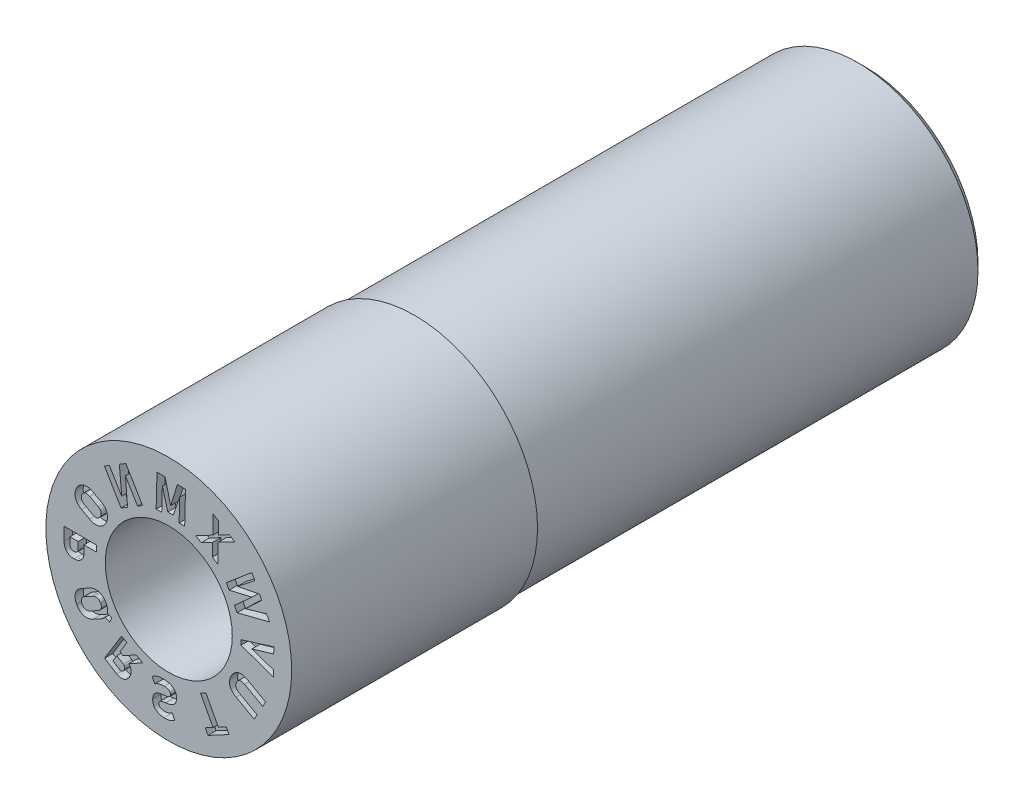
SolidWorks part; units mm, degrees
ref_plane "Front Plane" through (0, 0, 0) normal (0, 0, 1) x (1, 0, 0)
ref_plane "Top Plane" through (0, 0, 0) normal (0, 1, 0) x (1, 0, 0)
ref_plane "Right Plane" through (0, 0, 0) normal (1, 0, 0) x (0, 0, -1)
sketch "Sketch1" plane through (0, 0, 0) normal (1, 0, 0) x (0, 0, -1)
  line L2 (0, 3) -> (0, 1.55)
  line L3 (16.75, 3) -> (0, 3)
  line L4 (-3.7979, 0) -> (49996.2021, 0) construction
  line L8 (14, 0.8) -> (2.8, 0.8)
  line L9 (2.8, 1.55) -> (2.8, 0.8)
  line L10 (2.8, 1.55) -> (0, 1.55)
  line L12 (17, 1.5) -> (17, 2.75)
  line L16 (17, 2.75) -> (16.75, 3)
  line L17 (17, 1.5) -> (14, 1.5)
  line L18 (14, 0.8) -> (14, 1.5)
  dimension "D1" = 17
  dimension "D2" = 45
  dimension "D3" = 0.25
  dimension "D4" = 6
  dimension "D5" = 3.1
  dimension "D6" = 2.8
  dimension "D7" = 1.6
  dimension "D8" = 3
  dimension "D9" = 3
revolve "Revolve1" add sketch "Sketch1" angle 360 about L4
sketch "Sketch4" plane through (0, 0, 0) normal (1, 0, 0) x (0, 0, -1)
  line L0 (0, 0) -> (50000, 0) construction
  line L1 (17, -2.75) -> (17, 2.75) construction
  line L2 (6, 3.935) -> (17, 3.935)
  line L3 (6, 3.935) -> (6, 2.935)
  line L4 (6, 2.935) -> (17, 2.935)
  line L5 (17, 3.935) -> (17, 2.935)
  line L6 (16.75, 3) -> (0, 3) construction
  line L9 (0, 55) -> (0, -55) construction
  dimension "D1" = 1
  dimension "D2" = 0.065
  dimension "D3" = 6
revolve "Cut-Revolve1" cut sketch "Sketch4" angle 360 about L0
sketch "Sketch2" plane through (0, 0, 0) normal (0, 0, 1) x (1, 0, 0)
  line L0 (0, 0) -> (0, 3.4353) construction
  line L1 (0, 0) -> (1.7177, 2.9751) construction
  line L2 (0, 0) -> (2.9751, 1.7177) construction
  line L3 (0, 0) -> (3.4353, 0) construction
  line L4 (0, 0) -> (2.9751, -1.7177) construction
  line L5 (0, 0) -> (1.7177, -2.9751) construction
  line L6 (0, 0) -> (0, -3.4353) construction
  line L7 (0, 0) -> (-1.7177, -2.9751) construction
  line L8 (0, 0) -> (-2.9751, -1.7177) construction
  line L9 (0, 0) -> (-3.4353, 0) construction
  line L10 (0, 0) -> (-2.9751, 1.7177) construction
  line L11 (0, 0) -> (-1.7177, 2.9751) construction
  line L12 (2.27, 1.1094) -> (2.215, 1.216)
  line L13 (2.215, 1.216) -> (1.6756, 1.1087)
  line L14 (1.6756, 1.1087) -> (2.099, 1.4414)
  line L15 (2.099, 1.4414) -> (2.0286, 1.5782)
  line L16 (2.0286, 1.5782) -> (1.4075, 1.0528)
  line L17 (1.4075, 1.0528) -> (1.4718, 0.9277)
  line L18 (1.4718, 0.9277) -> (2.0287, 1.0563)
  line L19 (2.0287, 1.0563) -> (1.6037, 0.6719)
  line L20 (1.6037, 0.6719) -> (1.6681, 0.5468)
  line L21 (1.6681, 0.5468) -> (2.4564, 0.7472)
  line L22 (2.4564, 0.7472) -> (2.386, 0.884)
  line L23 (2.386, 0.884) -> (1.8692, 0.7325)
  line L24 (1.8692, 0.7325) -> (2.27, 1.1094)
  line L25 (-2.0688, 0.1133) -> (-1.761, 0.1125)
  line L26 (1.2076, 1.807) -> (1.6083, 2.0168)
  line L27 (1.6083, 2.0168) -> (1.4743, 2.0998)
  line L28 (1.4743, 2.0998) -> (1.2114, 1.9621)
  line L29 (-1.1147, -1.7532) -> (-1.1919, -1.7058)
  line L30 (1.0734, 1.8897) -> (0.6564, 1.6718)
  line L31 (0.6564, 1.6718) -> (0.7908, 1.5888)
  line L32 (0.7908, 1.5888) -> (1.0697, 1.735)
  line L33 (1.2114, 1.9621) -> (1.2187, 2.2579)
  line L34 (1.2187, 2.2579) -> (1.0843, 2.3409)
  line L35 (1.0843, 2.3409) -> (1.0734, 1.8897)
  line L36 (1.0697, 1.735) -> (1.0621, 1.421)
  line L37 (1.0621, 1.421) -> (1.1963, 1.3379)
  line L38 (1.1963, 1.3379) -> (1.2076, 1.807)
  line L39 (-0.0906, 2.5387) -> (-0.2877, 2.5439)
  line L40 (-0.2877, 2.5439) -> (-0.308, 1.7507)
  line L41 (-0.308, 1.7507) -> (-0.172, 1.7472)
  line L42 (-0.172, 1.7472) -> (-0.1576, 2.31)
  line L43 (-1.1919, -1.7058) -> (-1.025, -1.4337)
  line L44 (-0.1576, 2.31) -> (-0.0236, 1.8318)
  line L45 (-0.0236, 1.8318) -> (0.1085, 1.8284)
  line L46 (0.1085, 1.8284) -> (0.2667, 2.2897)
  line L47 (1.0806, -2.1716) -> (0.8899, -2.2734)
  line L48 (0.2667, 2.2897) -> (0.2524, 1.7363)
  line L49 (0.2524, 1.7363) -> (0.3882, 1.7328)
  line L50 (0.3882, 1.7328) -> (0.4085, 2.526)
  line L51 (0.4085, 2.526) -> (0.2116, 2.531)
  line L52 (0.2116, 2.531) -> (0.0468, 2.0004)
  line L53 (0.0468, 2.0004) -> (-0.0906, 2.5387)
  line L54 (-1.048, 2.3421) -> (-1.2055, 2.248)
  line L55 (-1.2055, 2.248) -> (-1.1495, 1.6028)
  line L57 (-1.1495, 1.6028) -> (-1.4485, 2.1029)
  line L58 (-1.4485, 2.1029) -> (-1.5717, 2.0292)
  line L59 (-1.5717, 2.0292) -> (-1.1635, 1.3463)
  line L60 (-1.1635, 1.3463) -> (-1.005, 1.441)
  line L61 (-1.005, 1.441) -> (-1.0576, 2.0787)
  line L63 (-1.0576, 2.0787) -> (-0.7629, 1.5857)
  line L64 (-0.7629, 1.5857) -> (-0.6398, 1.6592)
  line L65 (-0.6398, 1.6592) -> (-1.048, 2.3421)
  line L66 (-1.6537, 1.2347) -> (-1.8513, 1.343)
  line L67 (-2.1305, 0.8335) -> (-1.9329, 0.7252)
  line L68 (-1.8548, 0.8595) -> (-2.0593, 0.9715)
  line L69 (-1.9293, 1.2086) -> (-1.7248, 1.0966)
  line L70 (-2.2128, 0.1136) -> (-2.2132, -0.0587)
  line L71 (-2.4106, -0.0582) -> (-2.4102, 0.1141)
  line L73 (-2.5538, 0.264) -> (-2.5546, -0.0541)
  line L74 (-2.0692, -0.0554) -> (-2.0688, 0.1133)
  line L77 (-2.4102, 0.1141) -> (-2.2128, 0.1136)
  line L78 (-1.761, 0.1125) -> (-1.7606, 0.262)
  line L79 (-1.7606, 0.262) -> (-2.5538, 0.264)
  line L81 (-1.552, -1.16) -> (-1.4424, -1.2089)
  line L82 (-1.4424, -1.2089) -> (-1.3917, -1.0895)
  line L83 (-1.3917, -1.0895) -> (-1.496, -1.0431)
  line L84 (-1.9308, -0.7293) -> (-2.1286, -0.8382)
  line L85 (-1.848, -1.3483) -> (-1.6502, -1.2394)
  line L86 (-1.7217, -1.1011) -> (-1.9264, -1.2137)
  line L87 (-2.0571, -0.9765) -> (-1.8524, -0.8639)
  line L88 (-1.2672, -1.8286) -> (-1.1088, -1.9258)
  line L89 (-1.2063, -2.0849) -> (-1.3648, -1.9877)
  line L91 (-1.5675, -2.0322) -> (-1.2714, -2.2139)
  line L95 (-1.3648, -1.9877) -> (-1.2672, -1.8286)
  line L96 (-1.025, -1.4337) -> (-1.1525, -1.3555)
  line L97 (-1.1525, -1.3555) -> (-1.5675, -2.0322)
  line L99 (-0.9734, -1.8491) -> (-0.6409, -1.6695)
  line L100 (-0.6409, -1.6695) -> (-0.7953, -1.5747)
  line L101 (-0.7953, -1.5747) -> (-1.1147, -1.7532)
  line L102 (-0.403, -1.8332) -> (-0.3407, -1.9604)
  line L103 (0.0413, -1.9987) -> (0.0412, -1.9991)
  line L104 (-0.1094, -2.0852) -> (-0.1214, -2.0862)
  line L105 (-0.392, -2.3026) -> (-0.3921, -2.3033)
  line L106 (0.1458, -2.4949) -> (0.0898, -2.3647)
  line L107 (-0.2445, -2.3258) -> (-0.2446, -2.3253)
  line L108 (0.1894, -2.011) -> (0.1893, -2.0099)
  line L110 (1.2123, -2.1013) -> (0.9066, -1.5284)
  line L111 (0.9066, -1.5284) -> (0.7749, -1.5988)
  line L112 (0.7749, -1.5988) -> (1.0806, -2.1716)
  line L113 (0.9577, -2.4005) -> (1.4707, -2.1266)
  line L114 (1.4707, -2.1266) -> (1.4029, -1.9995)
  line L115 (1.4029, -1.9995) -> (1.2123, -2.1013)
  line L116 (0.8899, -2.2734) -> (0.9577, -2.4005)
  line L117 (1.6427, -1.2491) -> (2.0833, -1.4956)
  line L118 (2.0833, -1.4956) -> (2.1561, -1.3654)
  line L119 (2.1561, -1.3654) -> (1.7123, -1.1172)
  line L120 (1.8488, -0.8732) -> (2.2926, -1.1214)
  line L121 (2.2926, -1.1214) -> (2.3654, -0.9913)
  line L122 (2.3654, -0.9913) -> (1.9248, -0.7449)
  line L123 (2.5516, -0.37) -> (2.5546, -0.2161)
  line L124 (2.5546, -0.2161) -> (2.029, -0.0371)
  line L125 (2.029, -0.0371) -> (2.5614, 0.1209)
  line L126 (2.5614, 0.1209) -> (2.5644, 0.2748)
  line L127 (2.5644, 0.2748) -> (1.766, 0.0267)
  line L128 (1.766, 0.0267) -> (1.7636, -0.0902)
  line L129 (1.7636, -0.0902) -> (2.5516, -0.37)
  circle A0 centre (0, 0) radius 1.7947 construction
  spline S0 degree 3 poles (-1.5359, 0.839) (-1.5291, 0.8513) (-1.5201, 0.87) (-1.5105, 0.8956) (-1.5047, 0.9145) (-1.5002, 0.9334) (-1.4969, 0.9523) (-1.4952, 0.9712) (-1.4944, 0.9899) (-1.4952, 1.0086) (-1.4971, 1.0268) (-1.5002, 1.0449) (-1.5051, 1.0624) (-1.5106, 1.0797) (-1.5178, 1.0966) (-1.5263, 1.113) (-1.5357, 1.1292) (-1.5467, 1.1446) (-1.5585, 1.1597) (-1.5717, 1.1739) (-1.5859, 1.1874) (-1.6011, 1.2005) (-1.6234, 1.2168) (-1.6413, 1.2278) (-1.6537, 1.2347) knots 0 0 0 0 0.090417 0.133864 0.176276 0.217818 0.259154 0.299759 0.340251 0.380131 0.419768 0.458883 0.497906 0.537021 0.576163 0.61597 0.656312 0.697015 0.737895 0.779553 0.821787 0.864666 0.908561 1 1 1 1
  spline S1 degree 3 poles (-1.8513, 1.343) (-1.8638, 1.3497) (-1.8825, 1.3592) (-1.9085, 1.3688) (-1.9275, 1.3748) (-1.9466, 1.3795) (-1.9656, 1.3829) (-1.9846, 1.3847) (-2.0035, 1.3857) (-2.0222, 1.3848) (-2.0406, 1.3833) (-2.0586, 1.38) (-2.0762, 1.3756) (-2.0935, 1.37) (-2.1103, 1.363) (-2.127, 1.355) (-2.143, 1.3455) (-2.1584, 1.3348) (-2.1735, 1.3231) (-2.1876, 1.3102) (-2.2011, 1.2962) (-2.2139, 1.281) (-2.2303, 1.2592) (-2.2412, 1.2415) (-2.2479, 1.2292) knots 0 0 0 0 0.091509 0.13546 0.178154 0.220455 0.262042 0.302878 0.343583 0.383955 0.423455 0.462585 0.501839 0.540633 0.57985 0.619401 0.659411 0.700117 0.740632 0.781904 0.823734 0.866298 0.909762 1 1 1 1
  spline S2 degree 3 poles (-2.2479, 1.2292) (-2.2548, 1.217) (-2.2637, 1.1982) (-2.2734, 1.1726) (-2.2791, 1.1537) (-2.2839, 1.1348) (-2.2869, 1.1159) (-2.2889, 1.097) (-2.2895, 1.0781) (-2.2889, 1.0595) (-2.2867, 1.0411) (-2.2836, 1.0232) (-2.2791, 1.0056) (-2.2733, 0.9884) (-2.2662, 0.9716) (-2.258, 0.9551) (-2.2482, 0.9391) (-2.2376, 0.9235) (-2.2255, 0.9087) (-2.2126, 0.8943) (-2.1983, 0.8808) (-2.1831, 0.8677) (-2.1608, 0.8514) (-2.1429, 0.8404) (-2.1305, 0.8335) knots 0 0 0 0 0.090428 0.133879 0.176296 0.218093 0.259201 0.300026 0.340522 0.380882 0.420369 0.459489 0.498292 0.537327 0.576473 0.615974 0.65631 0.697004 0.737925 0.779528 0.821767 0.864651 0.908551 1 1 1 1
  spline S3 degree 3 poles (-1.9329, 0.7252) (-1.9204, 0.7185) (-1.9017, 0.7089) (-1.8757, 0.6995) (-1.8567, 0.6932) (-1.8376, 0.6888) (-1.8185, 0.6853) (-1.7994, 0.6834) (-1.7805, 0.6826) (-1.7618, 0.6829) (-1.7434, 0.685) (-1.7254, 0.688) (-1.7077, 0.6923) (-1.6904, 0.698) (-1.6735, 0.705) (-1.657, 0.7132) (-1.6409, 0.7227) (-1.6254, 0.7335) (-1.6104, 0.7451) (-1.5963, 0.758) (-1.5827, 0.7721) (-1.5699, 0.7872) (-1.5535, 0.8091) (-1.5426, 0.8268) (-1.5359, 0.839) knots 0 0 0 0 0.091419 0.135326 0.178245 0.220253 0.261799 0.303083 0.343748 0.38396 0.423573 0.462799 0.501686 0.540778 0.579956 0.619429 0.659747 0.700413 0.740888 0.782119 0.823908 0.86643 0.909851 1 1 1 1
  spline S4 degree 3 poles (-1.6675, 0.9111) (-1.6739, 0.9001) (-1.6842, 0.8841) (-1.7023, 0.8672) (-1.7164, 0.8566) (-1.7319, 0.8486) (-1.748, 0.8426) (-1.7651, 0.8394) (-1.7827, 0.8386) (-1.8007, 0.8399) (-1.8255, 0.8455) (-1.8434, 0.853) (-1.8548, 0.8595) knots 0 0 0 0 0.175066 0.257026 0.337672 0.416954 0.494877 0.572754 0.653437 0.735689 0.820268 1 1 1 1
  spline S5 degree 3 poles (-2.0593, 0.9715) (-2.0708, 0.9777) (-2.0867, 0.9888) (-2.1048, 1.0065) (-2.1157, 1.021) (-2.1247, 1.0363) (-2.1308, 1.0524) (-2.1348, 1.0692) (-2.136, 1.0866) (-2.1349, 1.1043) (-2.1303, 1.1286) (-2.1226, 1.146) (-2.1166, 1.1572) knots 0 0 0 0 0.179291 0.263984 0.346173 0.426703 0.505006 0.582502 0.662079 0.742384 0.824865 1 1 1 1
  spline S6 degree 3 poles (-2.1166, 1.1572) (-2.1105, 1.1684) (-2.0996, 1.1839) (-2.0819, 1.2011) (-2.0677, 1.2116) (-2.0523, 1.2197) (-2.0361, 1.2254) (-2.0191, 1.2287) (-2.0014, 1.2295) (-1.9834, 1.2281) (-1.9587, 1.2222) (-1.9407, 1.2151) (-1.9293, 1.2086) knots 0 0 0 0 0.175013 0.257189 0.337906 0.416522 0.494678 0.572624 0.653378 0.736149 0.820282 1 1 1 1
  spline S7 degree 3 poles (-1.7248, 1.0966) (-1.7133, 1.0903) (-1.6974, 1.0791) (-1.6793, 1.0615) (-1.6684, 1.047) (-1.6595, 1.0318) (-1.6533, 1.0156) (-1.6493, 0.9989) (-1.648, 0.9816) (-1.6491, 0.964) (-1.654, 0.9397) (-1.6614, 0.9222) (-1.6675, 0.9111) knots 0 0 0 0 0.180158 0.264225 0.346507 0.427127 0.505518 0.583101 0.661767 0.742163 0.825247 1 1 1 1
  spline S8 degree 3 poles (-2.2132, -0.0587) (-2.2132, -0.0672) (-2.2148, -0.0797) (-2.2198, -0.0954) (-2.2254, -0.1059) (-2.232, -0.1157) (-2.2403, -0.1242) (-2.2496, -0.1317) (-2.2603, -0.1379) (-2.2718, -0.1431) (-2.2889, -0.1477) (-2.3023, -0.1492) (-2.3115, -0.1491) knots 0 0 0 0 0.169702 0.250142 0.328711 0.407037 0.48557 0.564516 0.646217 0.731139 0.816416 1 1 1 1
  spline S9 degree 3 poles (-2.3115, -0.1491) (-2.3208, -0.1491) (-2.3346, -0.1479) (-2.3519, -0.1429) (-2.3637, -0.138) (-2.3743, -0.1318) (-2.3838, -0.1244) (-2.392, -0.1158) (-2.3989, -0.1061) (-2.4041, -0.0953) (-2.4094, -0.0795) (-2.4105, -0.0668) (-2.4106, -0.0582) knots 0 0 0 0 0.184774 0.271288 0.355539 0.436838 0.515203 0.59372 0.671031 0.749802 0.829807 1 1 1 1
  spline S10 degree 3 poles (-2.5546, -0.0541) (-2.5548, -0.0775) (-2.5514, -0.112) (-2.5387, -0.1554) (-2.5255, -0.1849) (-2.5089, -0.2117) (-2.489, -0.2355) (-2.4659, -0.2561) (-2.4398, -0.2732) (-2.4111, -0.2871) (-2.3686, -0.3002) (-2.3349, -0.3042) (-2.312, -0.304) knots 0 0 0 0 0.179097 0.263089 0.34501 0.42542 0.50381 0.581804 0.661048 0.742193 0.824608 1 1 1 1
  spline S11 degree 3 poles (-2.312, -0.304) (-2.2891, -0.3041) (-2.2553, -0.3006) (-2.213, -0.2874) (-2.1844, -0.2738) (-2.1583, -0.2568) (-2.1353, -0.2363) (-2.1155, -0.2126) (-2.0988, -0.186) (-2.0857, -0.1566) (-2.0725, -0.1134) (-2.0693, -0.0788) (-2.0692, -0.0554) knots 0 0 0 0 0.175511 0.257972 0.338737 0.418047 0.495879 0.574237 0.654395 0.73617 0.820238 1 1 1 1
  spline S12 degree 3 poles (-1.533, -0.8425) (-1.5396, -0.8301) (-1.5508, -0.8126) (-1.567, -0.7906) (-1.58, -0.7756) (-1.5936, -0.7616) (-1.6079, -0.7487) (-1.6228, -0.737) (-1.6384, -0.7263) (-1.6546, -0.7169) (-1.6711, -0.7087) (-1.6881, -0.7019) (-1.7053, -0.6961) (-1.723, -0.6919) (-1.7411, -0.6886) (-1.7596, -0.687) (-1.7784, -0.6865) (-1.7973, -0.687) (-1.8163, -0.6894) (-1.8354, -0.6924) (-1.8545, -0.6974) (-1.8736, -0.7033) (-1.8995, -0.7131) (-1.9183, -0.7227) (-1.9308, -0.7293) knots 0 0 0 0 0.090195 0.133685 0.176153 0.21789 0.25907 0.299873 0.340488 0.380409 0.420177 0.459306 0.497928 0.537094 0.576457 0.616177 0.656458 0.697162 0.738123 0.77964 0.821845 0.864668 0.90852 1 1 1 1
  spline S13 degree 3 poles (-2.1286, -0.8382) (-2.1409, -0.8452) (-2.159, -0.856) (-2.1812, -0.8726) (-2.1964, -0.8856) (-2.2108, -0.8991) (-2.2238, -0.9135) (-2.2358, -0.9285) (-2.2466, -0.9441) (-2.2562, -0.9602) (-2.2646, -0.9767) (-2.2716, -0.9936) (-2.2773, -1.0109) (-2.282, -1.0285) (-2.2851, -1.0465) (-2.2871, -1.0649) (-2.2878, -1.0835) (-2.287, -1.1024) (-2.2853, -1.1213) (-2.2819, -1.1402) (-2.2772, -1.1591) (-2.2715, -1.1781) (-2.2616, -1.2036) (-2.2526, -1.2224) (-2.2458, -1.2347) knots 0 0 0 0 0.091422 0.135239 0.178146 0.22039 0.261975 0.303164 0.343795 0.384056 0.423794 0.462866 0.501828 0.540782 0.58015 0.619563 0.659673 0.700093 0.740901 0.782164 0.823633 0.866196 0.909567 1 1 1 1
  spline S14 degree 3 poles (-2.2458, -1.2347) (-2.2392, -1.2471) (-2.228, -1.2645) (-2.2118, -1.2867) (-2.1987, -1.3016) (-2.1853, -1.3158) (-2.171, -1.3286) (-2.156, -1.3404) (-2.1404, -1.351) (-2.1243, -1.3605) (-2.1077, -1.3686) (-2.0908, -1.3757) (-2.0735, -1.3812) (-2.0558, -1.3858) (-2.0377, -1.3886) (-2.0193, -1.3905) (-2.0006, -1.391) (-1.9816, -1.3904) (-1.9626, -1.3883) (-1.9435, -1.3849) (-1.9244, -1.3803) (-1.9052, -1.3743) (-1.8793, -1.3645) (-1.8606, -1.3549) (-1.848, -1.3483) knots 0 0 0 0 0.090173 0.133652 0.176442 0.217915 0.259084 0.299878 0.340482 0.38074 0.420154 0.459214 0.498247 0.537295 0.576462 0.616016 0.656288 0.696981 0.738203 0.779453 0.821889 0.864701 0.908542 1 1 1 1
  spline S15 degree 3 poles (-1.6502, -1.2394) (-1.6379, -1.2323) (-1.6198, -1.2216) (-1.5976, -1.2049) (-1.5824, -1.1919) (-1.5681, -1.1783) (-1.5583, -1.1675) (-1.5531, -1.1613) (-1.552, -1.16) knots 0 0 0 0 0.091371 0.135164 0.178378 0.220178 0.26174 0.272413 0.272413 0.272413 0.272413
  spline S16 degree 3 poles (-1.6647, -0.9149) (-1.6586, -0.9262) (-1.6512, -0.9437) (-1.6461, -0.968) (-1.6451, -0.9857) (-1.6464, -1.003) (-1.6502, -1.0198) (-1.6565, -1.0359) (-1.6653, -1.0512) (-1.6761, -1.0658) (-1.6942, -1.0836) (-1.7101, -1.0949) (-1.7217, -1.1011) knots 0 0 0 0 0.175738 0.25757 0.338359 0.417478 0.494864 0.572915 0.653331 0.735404 0.819977 1 1 1 1
  spline S17 degree 3 poles (-1.9264, -1.2137) (-1.9379, -1.2199) (-1.9557, -1.2278) (-1.9806, -1.2332) (-1.9987, -1.2349) (-2.0163, -1.2339) (-2.0334, -1.2308) (-2.0496, -1.2248) (-2.0651, -1.2169) (-2.0794, -1.2064) (-2.0973, -1.1893) (-2.108, -1.1735) (-2.1143, -1.1623) knots 0 0 0 0 0.179094 0.264009 0.346524 0.426668 0.505058 0.582809 0.661917 0.742385 0.824306 1 1 1 1
  spline S18 degree 3 poles (-2.1143, -1.1623) (-2.1202, -1.1511) (-2.1279, -1.1337) (-2.1327, -1.1094) (-2.1339, -1.0918) (-2.1326, -1.0744) (-2.1287, -1.0576) (-2.1223, -1.0414) (-2.1136, -1.0261) (-2.1026, -1.0117) (-2.0846, -0.9938) (-2.0687, -0.9826) (-2.0571, -0.9765) knots 0 0 0 0 0.174878 0.257325 0.337598 0.416796 0.494956 0.573085 0.653582 0.735801 0.820459 1 1 1 1
  spline S19 degree 3 poles (-1.8524, -0.8639) (-1.8409, -0.8575) (-1.823, -0.8498) (-1.7983, -0.8441) (-1.7802, -0.8427) (-1.7626, -0.8434) (-1.7455, -0.8466) (-1.7293, -0.8525) (-1.7139, -0.8607) (-1.6996, -0.8711) (-1.6817, -0.8882) (-1.6708, -0.9036) (-1.6647, -0.9149) knots 0 0 0 0 0.179889 0.264361 0.346508 0.427089 0.505553 0.583377 0.662501 0.743044 0.825043 1 1 1 1
  spline S20 degree 3 poles (-1.1088, -1.9258) (-1.1025, -1.9294) (-1.0941, -1.9364) (-1.0851, -1.9476) (-1.08, -1.9567) (-1.0763, -1.9665) (-1.074, -1.9768) (-1.0733, -1.9877) (-1.0741, -1.999) (-1.0764, -2.0106) (-1.0814, -2.0267) (-1.087, -2.0384) (-1.0916, -2.0459) knots 0 0 0 0 0.160364 0.237859 0.313887 0.390284 0.466266 0.546044 0.629075 0.716185 0.805143 1 1 1 1
  spline S21 degree 3 poles (-1.0916, -2.0459) (-1.096, -2.0535) (-1.1038, -2.0638) (-1.1157, -2.0756) (-1.1249, -2.0829) (-1.1348, -2.0885) (-1.1447, -2.093) (-1.1549, -2.0955) (-1.1653, -2.0969) (-1.1757, -2.0962) (-1.1899, -2.0935) (-1.2, -2.0888) (-1.2063, -2.0849) knots 0 0 0 0 0.192245 0.281877 0.368857 0.450818 0.530412 0.606943 0.682726 0.759211 0.836072 1 1 1 1
  spline S22 degree 3 poles (-1.2714, -2.2139) (-1.2537, -2.2246) (-1.226, -2.238) (-1.1868, -2.2471) (-1.1579, -2.2499) (-1.1294, -2.2482) (-1.1014, -2.2426) (-1.0743, -2.2325) (-1.0482, -2.2187) (-1.0234, -2.2011) (-0.9919, -2.1717) (-0.9719, -2.1455) (-0.9604, -2.1264) knots 0 0 0 0 0.170511 0.251264 0.330555 0.409169 0.486587 0.565367 0.64627 0.729871 0.815831 1 1 1 1
  spline S23 degree 3 poles (-0.9604, -2.1264) (-0.9488, -2.1073) (-0.9339, -2.0777) (-0.9224, -2.0363) (-0.9177, -2.0061) (-0.9173, -1.9766) (-0.9207, -1.9478) (-0.9285, -1.9204) (-0.9402, -1.8941) (-0.9552, -1.8701) (-0.9672, -1.8557) (-0.9734, -1.8491) knots 0 0 0 0 0.184351 0.270499 0.353948 0.435216 0.513625 0.591508 0.669793 0.749625 0.824263 0.824263 0.824263 0.824263
  spline S24 degree 3 poles (-0.0991, -1.752) (-0.1178, -1.7507) (-0.1459, -1.7508) (-0.1831, -1.7534) (-0.2105, -1.7569) (-0.2375, -1.7617) (-0.264, -1.7678) (-0.2895, -1.7757) (-0.3144, -1.7846) (-0.3383, -1.7949) (-0.3686, -1.8098) (-0.3896, -1.8236) (-0.403, -1.8332) knots 0 0 0 0 0.175416 0.262021 0.348577 0.434225 0.518718 0.602045 0.68455 0.765576 0.845407 1 1 1 1
  spline S25 degree 3 poles (-0.3407, -1.9604) (-0.3247, -1.9486) (-0.2987, -1.9331) (-0.2613, -1.9174) (-0.2316, -1.9079) (-0.201, -1.9008) (-0.1596, -1.8943) (-0.1281, -1.894) (-0.1072, -1.895) knots 0 0 0 0 0.241526 0.365037 0.491761 0.619343 0.745896 1 1 1 1
  spline S26 degree 3 poles (-0.1072, -1.895) (-0.0957, -1.8959) (-0.0789, -1.8972) (-0.0574, -1.9011) (-0.0428, -1.9047) (-0.0292, -1.9088) (-0.0168, -1.914) (-0.0054, -1.9196) (0.0049, -1.9261) (0.014, -1.9331) (0.0218, -1.9408) (0.0285, -1.949) (0.0336, -1.9579) (0.0377, -1.9672) (0.041, -1.9809) (0.0417, -1.9915) (0.0413, -1.9987) knots 0 0 0 0 0.170677 0.249019 0.323 0.392902 0.459277 0.52134 0.58161 0.637818 0.691741 0.743614 0.793212 0.843555 0.893764 1 1 1 1
  spline S27 degree 3 poles (0.0412, -1.9991) (0.0408, -2.0088) (0.0379, -2.0227) (0.0292, -2.0389) (0.0206, -2.0487) (0.0103, -2.0569) (-0.0014, -2.0636) (-0.0142, -2.0692) (-0.0285, -2.0733) (-0.0444, -2.0765) (-0.0694, -2.0808) (-0.0892, -2.0832) (-0.1031, -2.0844) knots 0 0 0 0 0.15562 0.226283 0.29512 0.36531 0.436884 0.512161 0.590594 0.676778 0.774614 1 1 1 1
  spline S28 degree 3 poles (-0.1031, -2.0844) (-0.1041, -2.085) (-0.1063, -2.0849) (-0.1084, -2.0848) (-0.1094, -2.0852) knots 0 0 0 0 0.504196 1 1 1 1
  spline S29 degree 3 poles (-0.1214, -2.0862) (-0.146, -2.0888) (-0.1814, -2.0929) (-0.2258, -2.1023) (-0.2548, -2.1095) (-0.2813, -2.1192) (-0.3056, -2.1328) (-0.328, -2.1501) (-0.345, -2.1672) (-0.3574, -2.1829) (-0.3657, -2.1961) (-0.3728, -2.2107) (-0.3787, -2.2266) (-0.3837, -2.2438) (-0.3892, -2.2691) (-0.3911, -2.289) (-0.392, -2.3026) knots 0 0 0 0 0.190654 0.273941 0.349427 0.420098 0.490876 0.562744 0.637428 0.675985 0.716053 0.757512 0.800768 0.846658 0.895026 1 1 1 1
  spline S30 degree 3 poles (-0.3921, -2.3033) (-0.3928, -2.3156) (-0.393, -2.334) (-0.3904, -2.358) (-0.3879, -2.375) (-0.384, -2.3915) (-0.3788, -2.4072) (-0.3727, -2.4224) (-0.3655, -2.4368) (-0.3573, -2.4507) (-0.3476, -2.4635) (-0.3375, -2.476) (-0.3259, -2.4874) (-0.3136, -2.4981) (-0.3001, -2.5081) (-0.2856, -2.5173) (-0.2701, -2.5259) (-0.2537, -2.5335) (-0.2363, -2.5402) (-0.2181, -2.5464) (-0.1989, -2.5513) (-0.1789, -2.5557) (-0.1504, -2.5602) (-0.1286, -2.5627) (-0.1136, -2.5633) knots 0 0 0 0 0.086193 0.127121 0.167038 0.205954 0.244115 0.28193 0.319274 0.356372 0.393427 0.430721 0.46769 0.505864 0.544412 0.584049 0.624955 0.666819 0.709819 0.754195 0.799943 0.847313 0.896373 1 1 1 1
  spline S31 degree 3 poles (-0.1136, -2.5633) (-0.0993, -2.564) (-0.0775, -2.5641) (-0.0482, -2.5617) (-0.0183, -2.5576) (0.019, -2.5495) (0.0777, -2.5311) (0.1194, -2.5108) (0.1458, -2.4949) knots 0 0 0 0 0.158393 0.240052 0.323318 0.491049 0.660456 1 1 1 1
  spline S32 degree 3 poles (0.0898, -2.3647) (0.0742, -2.3742) (0.0501, -2.3868) (0.0167, -2.4004) (-0.0083, -2.4088) (-0.0333, -2.4149) (-0.0656, -2.4205) (-0.0897, -2.4214) (-0.1054, -2.4205) knots 0 0 0 0 0.265833 0.396076 0.524578 0.649927 0.770631 1 1 1 1
  spline S33 degree 3 poles (-0.1054, -2.4205) (-0.1162, -2.4196) (-0.132, -2.4185) (-0.1521, -2.4146) (-0.1658, -2.4114) (-0.1784, -2.4076) (-0.1901, -2.4031) (-0.2007, -2.3979) (-0.2103, -2.3919) (-0.2189, -2.3855) (-0.2262, -2.3784) (-0.2325, -2.371) (-0.2373, -2.3629) (-0.241, -2.3544) (-0.2442, -2.342) (-0.2449, -2.3323) (-0.2445, -2.3258) knots 0 0 0 0 0.172873 0.252209 0.326759 0.396746 0.462659 0.525763 0.585763 0.642831 0.69615 0.747834 0.797535 0.846062 0.895882 1 1 1 1
  spline S34 degree 3 poles (-0.2446, -2.3253) (-0.244, -2.3149) (-0.2412, -2.2997) (-0.2316, -2.2823) (-0.2221, -2.2719) (-0.2111, -2.2632) (-0.199, -2.2559) (-0.1857, -2.25) (-0.1711, -2.2455) (-0.1545, -2.2419) (-0.1271, -2.236) (-0.1048, -2.2334) (-0.0891, -2.2308) knots 0 0 0 0 0.156303 0.226416 0.295801 0.365383 0.43556 0.507496 0.581531 0.664437 0.761877 1 1 1 1
  spline S35 degree 3 poles (-0.0891, -2.2308) (-0.0877, -2.2303) (-0.0847, -2.2306) (-0.0817, -2.2299) (-0.0802, -2.2297) knots 0 0 0 0 0.498578 1 1 1 1
  spline S36 degree 3 poles (-0.0802, -2.2297) (-0.0781, -2.2293) (-0.0738, -2.229) (-0.0697, -2.2278) (-0.0675, -2.2277) knots 0 0 0 0 0.492192 1 1 1 1
  spline S37 degree 3 poles (-0.0675, -2.2277) (-0.0441, -2.2245) (-0.0104, -2.2186) (0.032, -2.2081) (0.0599, -2.1998) (0.0853, -2.189) (0.1085, -2.1749) (0.1297, -2.1573) (0.1457, -2.1402) (0.1572, -2.1248) (0.1647, -2.1118) (0.1715, -2.0978) (0.177, -2.0825) (0.1818, -2.0662) (0.1865, -2.0423) (0.1887, -2.0238) (0.1894, -2.011) knots 0 0 0 0 0.18944 0.273135 0.34986 0.422336 0.49372 0.566657 0.64192 0.680781 0.720567 0.762196 0.805318 0.850441 0.897677 1 1 1 1
  spline S38 degree 3 poles (0.1893, -2.0099) (0.1901, -1.9977) (0.1902, -1.9796) (0.1876, -1.956) (0.1849, -1.9391) (0.1807, -1.9229) (0.1754, -1.9073) (0.1691, -1.8923) (0.1615, -1.8779) (0.153, -1.8642) (0.1432, -1.8513) (0.1323, -1.8392) (0.1207, -1.8276) (0.1076, -1.8171) (0.0937, -1.8071) (0.0787, -1.7979) (0.0626, -1.7895) (0.0457, -1.7818) (0.0276, -1.7752) (0.0087, -1.7692) (-0.011, -1.7638) (-0.0318, -1.7597) (-0.0611, -1.7549) (-0.0838, -1.7529) (-0.0991, -1.752) knots 0 0 0 0 0.083525 0.123521 0.162624 0.200431 0.237878 0.275019 0.31194 0.348682 0.385722 0.422532 0.460081 0.497924 0.537214 0.577134 0.618356 0.661035 0.704769 0.749895 0.796517 0.844658 0.894874 1 1 1 1
  spline S39 degree 3 poles (1.5266, -0.8539) (1.5194, -0.8667) (1.5097, -0.8861) (1.499, -0.9124) (1.4927, -0.9317) (1.4877, -0.9508) (1.4838, -0.9697) (1.4813, -0.9883) (1.4803, -1.0068) (1.4807, -1.025) (1.4823, -1.0428) (1.4852, -1.0603) (1.4895, -1.0774) (1.4953, -1.0941) (1.5022, -1.1105) (1.5106, -1.1265) (1.5202, -1.1422) (1.5311, -1.1574) (1.5434, -1.1721) (1.5569, -1.1862) (1.5716, -1.2) (1.5875, -1.2132) (1.6109, -1.2302) (1.6297, -1.2418) (1.6427, -1.2491) knots 0 0 0 0 0.093937 0.138578 0.18191 0.223878 0.264885 0.304862 0.344288 0.383101 0.421208 0.458812 0.496452 0.534282 0.571946 0.610338 0.649665 0.689434 0.73022 0.771831 0.814765 0.858838 0.904323 1 1 1 1
  spline S40 degree 3 poles (1.7123, -1.1172) (1.7028, -1.112) (1.6896, -1.1033) (1.6739, -1.0902) (1.6637, -1.0801) (1.6553, -1.0692) (1.6478, -1.058) (1.6422, -1.0461) (1.6376, -1.0338) (1.6346, -1.0212) (1.6331, -1.0082) (1.6331, -0.995) (1.6345, -0.9816) (1.6375, -0.9679) (1.6435, -0.9489) (1.6503, -0.9351) (1.6553, -0.9259) knots 0 0 0 0 0.142498 0.2078 0.270674 0.331618 0.390026 0.447986 0.505383 0.562354 0.619698 0.677218 0.736612 0.797556 0.861664 1 1 1 1
  spline S41 degree 3 poles (1.6553, -0.9259) (1.6604, -0.9167) (1.6687, -0.9035) (1.682, -0.8885) (1.6921, -0.8785) (1.7029, -0.8702) (1.7142, -0.8632) (1.7261, -0.8576) (1.7385, -0.8534) (1.7513, -0.8507) (1.7645, -0.8495) (1.7779, -0.8497) (1.7917, -0.8516) (1.8057, -0.8546) (1.8251, -0.8612) (1.8395, -0.8677) (1.8488, -0.8732) knots 0 0 0 0 0.138603 0.203137 0.26484 0.323984 0.382076 0.439108 0.496509 0.553647 0.611309 0.670263 0.730229 0.793355 0.858211 1 1 1 1
  spline S42 degree 3 poles (1.9248, -0.7449) (1.9117, -0.7376) (1.892, -0.7277) (1.8651, -0.7167) (1.8455, -0.7102) (1.8262, -0.7046) (1.8071, -0.7007) (1.7881, -0.6981) (1.7694, -0.6966) (1.751, -0.6967) (1.733, -0.698) (1.7154, -0.7007) (1.6981, -0.7046) (1.6813, -0.7101) (1.6648, -0.7167) (1.6487, -0.7247) (1.633, -0.734) (1.6178, -0.7447) (1.6032, -0.7566) (1.5889, -0.7697) (1.5754, -0.7842) (1.5621, -0.7996) (1.5455, -0.8228) (1.5336, -0.841) (1.5266, -0.8539) knots 0 0 0 0 0.095751 0.14106 0.185052 0.227689 0.269335 0.309934 0.349876 0.388964 0.427304 0.465096 0.502875 0.54045 0.578145 0.616172 0.655081 0.694747 0.734674 0.775726 0.818151 0.861264 0.905889 1 1 1 1
  spline S43 degree 3 poles (-1.496, -1.0431) (-1.4952, -1.0391) (-1.4934, -1.0289) (-1.4919, -1.0125) (-1.4911, -0.9938) (-1.4918, -0.9749) (-1.4936, -0.956) (-1.497, -0.9371) (-1.5015, -0.9181) (-1.5073, -0.8991) (-1.5171, -0.8736) (-1.5262, -0.8548) (-1.533, -0.8425) knots 0.553288 0.553288 0.553288 0.553288 0.579975 0.61952 0.659607 0.700292 0.740803 0.782044 0.823731 0.866271 0.909617 1 1 1 1
  point P17 (0, 0)
  point P446 (0, 0.0044)
  point P447 (0.0044, 0.0044)
  point P448 (0.0044, 0)
  dimension "D1" = 12
extrude "Cut-Extrude1" cut sketch "Sketch2" against normal blind 0.2
sketch "Sketch3" plane through (0, 0, -2.8) normal (0, 0, 1) x (1, 0, 0)
  line L0 (0, 0) -> (0, 50000) construction
  line L1 (0.4619, 0.8) -> (-0.4619, 0.8)
  line L2 (-0.4619, 0.8) -> (-0.9238, 0)
  line L3 (-0.9238, 0) -> (-0.4619, -0.8)
  line L4 (-0.4619, -0.8) -> (0.4619, -0.8)
  line L5 (0.4619, -0.8) -> (0.9238, 0)
  line L6 (0.9238, 0) -> (0.4619, 0.8)
  line L7 (0, 0) -> (50000, 0) construction
  circle A0 centre (0, 0) radius 0.8 construction
  circle A1 centre (0, 0) radius 0.8 construction
extrude "Cut-Extrude2" cut sketch "Sketch3" against normal blind 1.4
